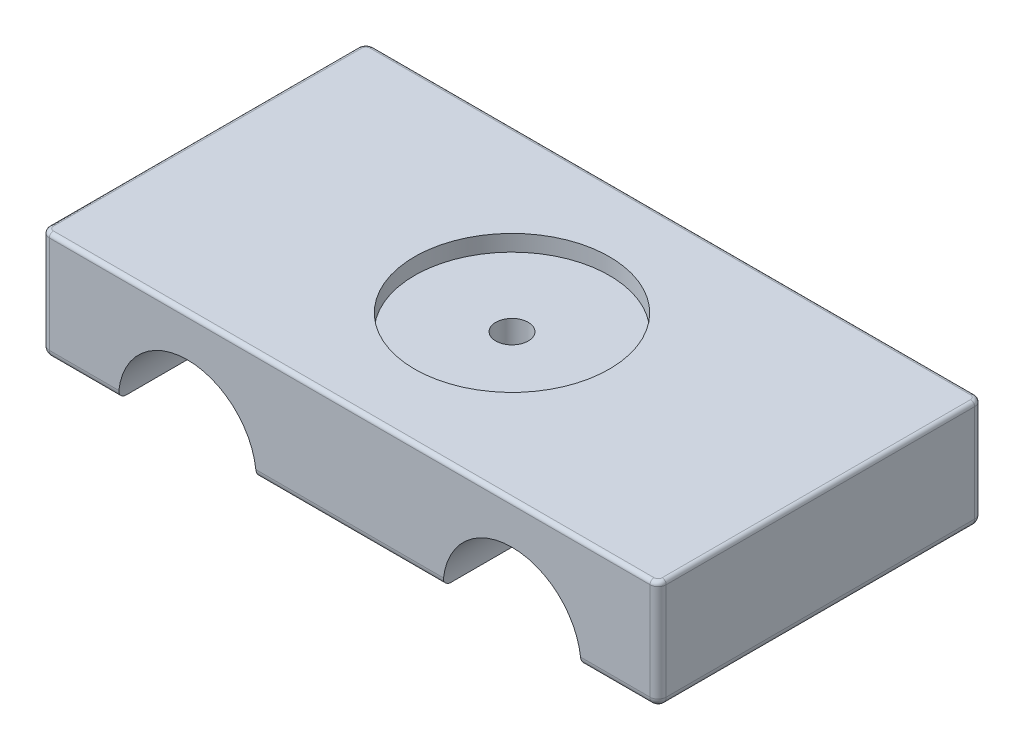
SolidWorks part; units mm, degrees
ref_plane "Front Plane" through (0, 0, 0) normal (0, 0, 1) x (1, 0, 0)
ref_plane "Top Plane" through (0, 0, 0) normal (0, 1, 0) x (1, 0, 0)
ref_plane "Right Plane" through (0, 0, 0) normal (1, 0, 0) x (0, 0, -1)
sketch "Sketch1" plane through (0, 0, 0) normal (0, 0, 1) x (1, 0, 0)
  line L0 (0, -40.1089) -> (0, -62.3)
  line L1 (0, -40.1089) -> (0, 96.4)
  line L2 (12.7, -75) -> (952.5, -75)
  line L3 (0, -200) -> (965.2, -200)
  line L5 (0, -100) -> (228.6, -100)
  line L6 (0, -175) -> (736.6, -175)
  line L7 (228.6, -100) -> (228.6, -75)
  line L8 (736.6, -175) -> (736.6, -75)
  line L12 (965.2, -62.3) -> (965.2, 25)
  line L15 (965.2, 25) -> (965.2, 96.4)
  line L17 (0, 96.4) -> (965.2, 96.4)
  circle A1 centre (228.6, -75) radius 107.95
  circle A2 centre (736.6, -75) radius 107.95
  arc A4 (0, -62.3) -> (12.7, -75) centre (12.7, -62.3) ccw
  arc A6 (952.5, -75) -> (965.2, -62.3) centre (952.5, -62.3) ccw
  point P6 (0, 0)
  point P21 (0, -75)
  point P26 (965.2, -75)
  dimension "D5" = 215.9
  dimension "D6" = 215.9
  dimension "D8" = 12.7
  dimension "D10" = 12.7
  dimension "D1" = 965.2
  dimension "D2" = 965.2
  dimension "D3" = 228.6
  dimension "D4" = 736.6
extrude "Boss-Extrude1" add sketch "Sketch1" along normal blind 508
fillet "Fillet1" radius 12.7 14 edges at (66.675, -75, 0) (3.7197, -71.2803, 0) (0, 17.05, 0) (898.525, -75, 0) (961.4803, -71.2803, 0) (965.2, 17.05, 0) (965.2, 17.05, 508) (961.4803, -71.2803, 508) (898.525, -75, 508) (482.6, -75, 508) (66.675, -75, 508) (3.7197, -71.2803, 508) (0, 17.05, 508) (482.6, -75, 0)
sketch "Sketch2" plane through (0, -75, 0) normal (0, -1, 0) x (1, 0, 0)
  line L0 (120.65, 249.4181) -> (336.55, 249.4181)
  line L1 (120.65, 495.3) -> (120.65, 12.7) construction
  line L2 (336.55, 495.3) -> (336.55, 12.7) construction
  line L3 (228.6, 508) -> (228.6, 469.9)
  line L5 (228.6, 0) -> (228.6, 38.1)
  line L7 (121.3997, 0) -> (335.8003, 0) construction
  line L8 (335.8003, 508) -> (121.3997, 508) construction
  line L9 (736.6, 508) -> (736.6, 469.9)
  line L10 (843.8003, 508) -> (629.3997, 508) construction
  line L11 (736.6, 0) -> (736.6, 38.1)
  line L12 (629.3997, 0) -> (843.8003, 0) construction
  circle A0 centre (228.6, 469.9) radius 7.62
  circle A1 centre (228.6, 38.1) radius 7.62
  circle A2 centre (736.6, 469.9) radius 7.62
  circle A3 centre (736.6, 38.1) radius 7.62
  dimension "D5" = 15.24
  dimension "D6" = 15.24
  dimension "D7" = 15.24
  dimension "D8" = 15.24
  dimension "D1" = 38.1
  dimension "D2" = 38.1
  dimension "D3" = 38.1
  dimension "D4" = 38.1
extrude "Cut-Extrude1" cut sketch "Sketch2" against normal blind 132.08 contours A1 | A0 | A2 | A3
sketch "Sketch3" plane through (0, -75, 0) normal (0, -1, 0) x (1, 0, 0)
  line L0 (336.55, 495.3) -> (336.55, 12.7) construction
  line L1 (350.012, 481.838) -> (615.188, 481.838)
  line L2 (350.012, 481.838) -> (350.012, 26.162)
  line L3 (350.012, 26.162) -> (615.188, 26.162)
  line L4 (615.188, 481.838) -> (615.188, 26.162)
  line L5 (628.65, 495.3) -> (336.55, 495.3) construction
  line L6 (628.65, 495.3) -> (628.65, 12.7) construction
  line L7 (336.55, 12.7) -> (628.65, 12.7) construction
  dimension "D1" = 13.462
  dimension "D2" = 13.462
  dimension "D3" = 13.462
  dimension "D4" = 13.462
extrude "Cut-Extrude2" cut sketch "Sketch3" against normal blind 88.9 contours L2 L1 L4 L3
sketch "Sketch4" plane through (0, -75, 0) normal (0, -1, 0) x (1, 0, 0)
  line L0 (844.55, 495.3) -> (844.55, 12.7) construction
  line L1 (858.012, 481.838) -> (939.038, 481.838)
  line L2 (858.012, 481.838) -> (858.012, 26.162)
  line L3 (858.012, 26.162) -> (939.038, 26.162)
  line L4 (939.038, 481.838) -> (939.038, 26.162)
  line L5 (952.5, 495.3) -> (952.5, 12.7) construction
  line L6 (844.55, 12.7) -> (952.5, 12.7) construction
  line L7 (952.5, 495.3) -> (844.55, 495.3) construction
  dimension "D1" = 13.462
  dimension "D2" = 13.462
  dimension "D3" = 13.462
  dimension "D4" = 13.462
extrude "Cut-Extrude3" cut sketch "Sketch4" against normal blind 157.988
sketch "Sketch5" plane through (0, -75, 0) normal (0, -1, 0) x (1, 0, 0)
  line L0 (120.65, 495.3) -> (12.7, 495.3) construction
  line L1 (26.162, 481.838) -> (107.188, 481.838)
  line L2 (26.162, 481.838) -> (26.162, 26.162)
  line L3 (26.162, 26.162) -> (107.188, 26.162)
  line L4 (107.188, 481.838) -> (107.188, 26.162)
  line L5 (120.65, 495.3) -> (120.65, 12.7) construction
  line L6 (12.7, 495.3) -> (12.7, 12.7) construction
  line L7 (12.7, 12.7) -> (120.65, 12.7) construction
  dimension "D1" = 13.462
  dimension "D2" = 13.462
  dimension "D3" = 13.462
  dimension "D4" = 13.462
extrude "Cut-Extrude4" cut sketch "Sketch5" against normal blind 72.898
fillet "Fillet3" radius 6.35 8 edges at (3.7197, 96.4, 504.2803) (482.6, 96.4, 508) (961.4803, 96.4, 504.2803) (965.2, 96.4, 254) (961.4803, 96.4, 3.7197) (482.6, 96.4, 0) (3.7197, 96.4, 3.7197) (0, 96.4, 254)
sketch "Sketch7" plane through (0, 96.4, 0) normal (0, 1, 0) x (1, 0, 0)
  line L0 (482.6, -6.35) -> (482.6, -501.65)
  line L1 (952.5, -6.35) -> (12.7, -6.35) construction
  line L2 (12.7, -501.65) -> (952.5, -501.65) construction
  circle A0 centre (482.6, -254) radius 25.4
  dimension "D1" = 50.8
extrude "Cut-Extrude5" cut sketch "Sketch7" against normal blind 76.2 contours L0 A0 | L0 A0
sketch "Sketch8" plane through (0, 96.4, 0) normal (0, 1, 0) x (1, 0, 0)
  circle A0 centre (482.6, -254) radius 152.4
extrude "Cut-Extrude6" cut sketch "Sketch8" against normal blind 25.4
